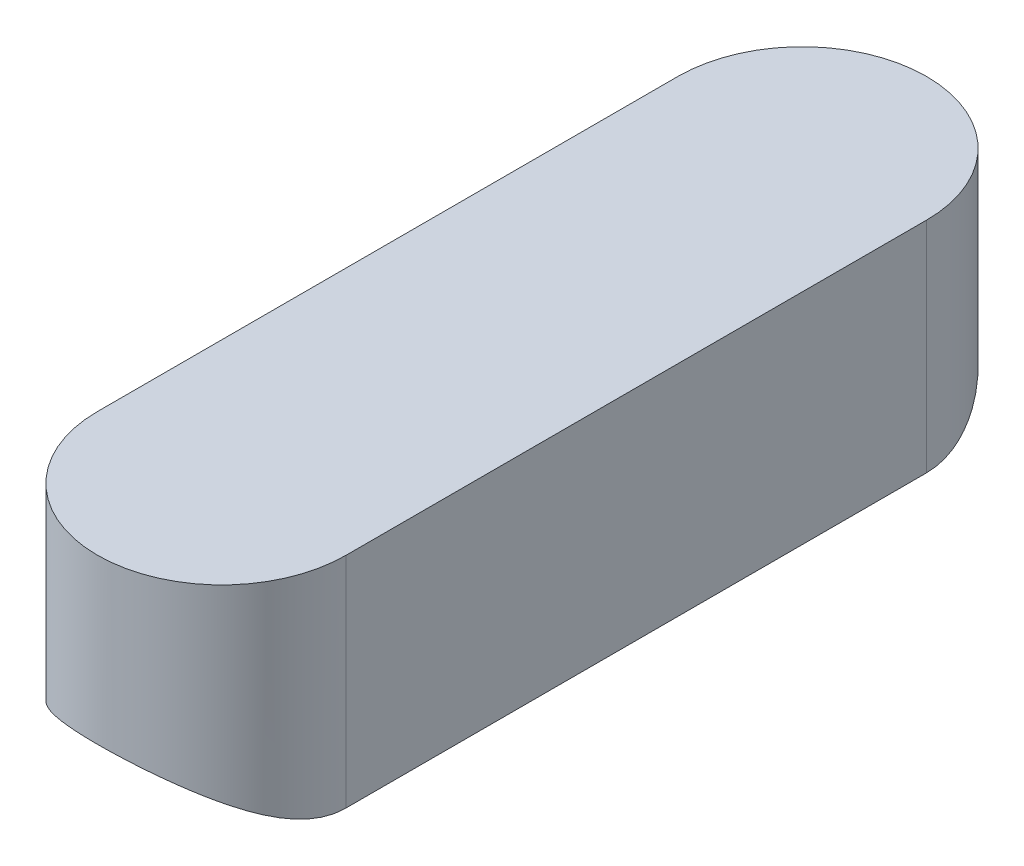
SolidWorks part; units mm, degrees
ref_plane "Front Plane" through (0, 0, 0) normal (0, 0, 1) x (1, 0, 0)
ref_plane "Top Plane" through (0, 0, 0) normal (0, 1, 0) x (1, 0, 0)
ref_plane "Right Plane" through (0, 0, 0) normal (1, 0, 0) x (0, 0, -1)
sketch "Sketch1" plane through (0, 0, 0) normal (0, 0, 1) x (1, 0, 0)
  line L2 (3, 2.7208) -> (3, 8)
  line L3 (3, 8) -> (-3, 8)
  line L4 (-3, 2.7208) -> (-3, 8)
  line L5 (0, 0) -> (-3, 8) construction
  line L6 (3, 8) -> (0, 0) construction
  arc A0 (3, 2.7208) -> (-3, 2.7208) centre (0, 0) ccw
  dimension "D1" = 4.05
  dimension "D2" = 6
  dimension "D3" = 8
  dimension "D4" = 3
extrude "Boss-Extrude1" add sketch "Sketch1" along normal blind 20
sketch "Sketch2" plane through (0, 8, 0) normal (0, 1, 0) x (1, 0, 0)
  line L0 (0, 0) -> (0, -21.0822) construction
  line L1 (3, -20) -> (-3, -20) construction
  line L2 (-3, -3) -> (-3, -17)
  line L3 (3, -3) -> (3, -17)
  arc A0 (3, -3) -> (-3, -3) centre (0, -3) ccw
  arc A1 (-3, -17) -> (3, -17) centre (0, -17) ccw
  dimension "D1" = 6
  dimension "D2" = 6
extrude "Cut-Extrude2" cut sketch "Sketch2" against normal through all flip side to cut
